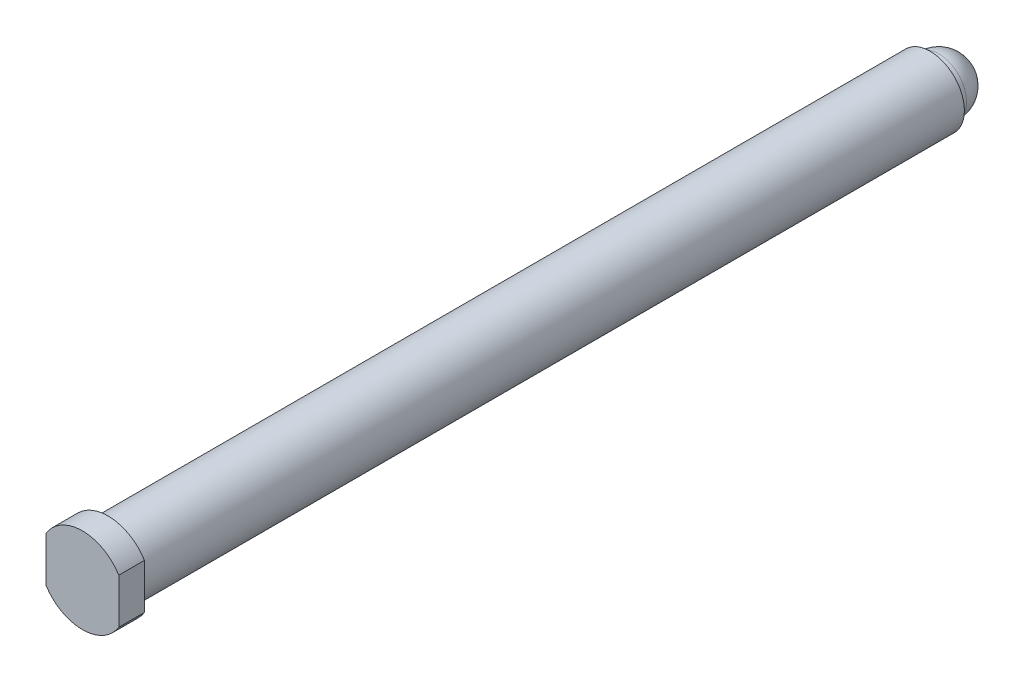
SolidWorks part; units mm, degrees
ref_plane "Plan de face" through (0, 0, 0) normal (0, 0, 1) x (1, 0, 0)
ref_plane "Plan de dessus" through (0, 0, 0) normal (0, 1, 0) x (1, 0, 0)
ref_plane "Plan de droite" through (0, 0, 0) normal (1, 0, 0) x (0, 0, -1)
sketch "Esquisse1" plane through (0, 0, 0) normal (1, 0, 0) x (0, 0, -1)
  line L0 (0, 0) -> (216.1831, 0) construction
  line L1 (0, 0) -> (0, 10)
  line L2 (0, 10) -> (6, 10)
  line L3 (6, 10) -> (6, 8)
  line L4 (6, 8) -> (198, 8)
  line L5 (198, 8) -> (198, 6.5)
  line L6 (200, 6.5) -> (198, 6.5)
  line L7 (0, 0) -> (206.5, 0)
  arc A0 (206.5, 0) -> (200, 6.5) centre (200, 0) ccw
  dimension "D1" = 13
  dimension "D2" = 16
  dimension "D3" = 6
  dimension "D4" = 20
  dimension "D5" = 2
  dimension "D6" = 200
revolve "Révolution2" add sketch "Esquisse1" angle 360 about L0
hole_wizard "Trou taraudé M6x1.01" positions "Esquisse3D2" profile "Esquisse3" tap size "M6x1.0" standard "ISO"
sketch3d "Esquisse3D2"
  point P0 (0, 0, -206.5)
sketch "Esquisse3" plane through (0, 0, -206.5) normal (1, 0, 0) x (0, 1, 0)
  line L0 (0, 0) -> (0, 18.4434)
  line L1 (0, 18.4434) -> (2.5, 17)
  line L2 (2.5, 17) -> (2.5, 0)
  line L5 (2.5, 0) -> (0, 0)
  line L10 (0, 18.4434) -> (-2.5, 17) construction
  line L11 (0, -6.35) -> (0, 107.95) construction
  dimension "Diamètre du trou pour taraudage" = 5
  dimension "Profondeur du trou pour taraudage" = 17
  dimension "Angle de pointe" = 120
chamfer "Chanfrein1" distance 1 angle 45 1 edges at (0, -2.5, -206)
sketch "Esquisse4" plane through (0, 0, 0) normal (0, 0, 1) x (1, 0, 0)
  line L1 (-8.5, 10.3009) -> (8.5, 10.3009)
  line L2 (-8.5, 10.3009) -> (-8.5, -10.2431)
  line L3 (-8.5, -10.2431) -> (8.5, -10.2431)
  line L4 (8.5, 10.3009) -> (8.5, -10.2431)
  dimension "D1" = 8.5
  dimension "D2" = 17
extrude "Enlèv. mat.-Extru.1" cut sketch "Esquisse4" against normal blind 6 flip side to cut
